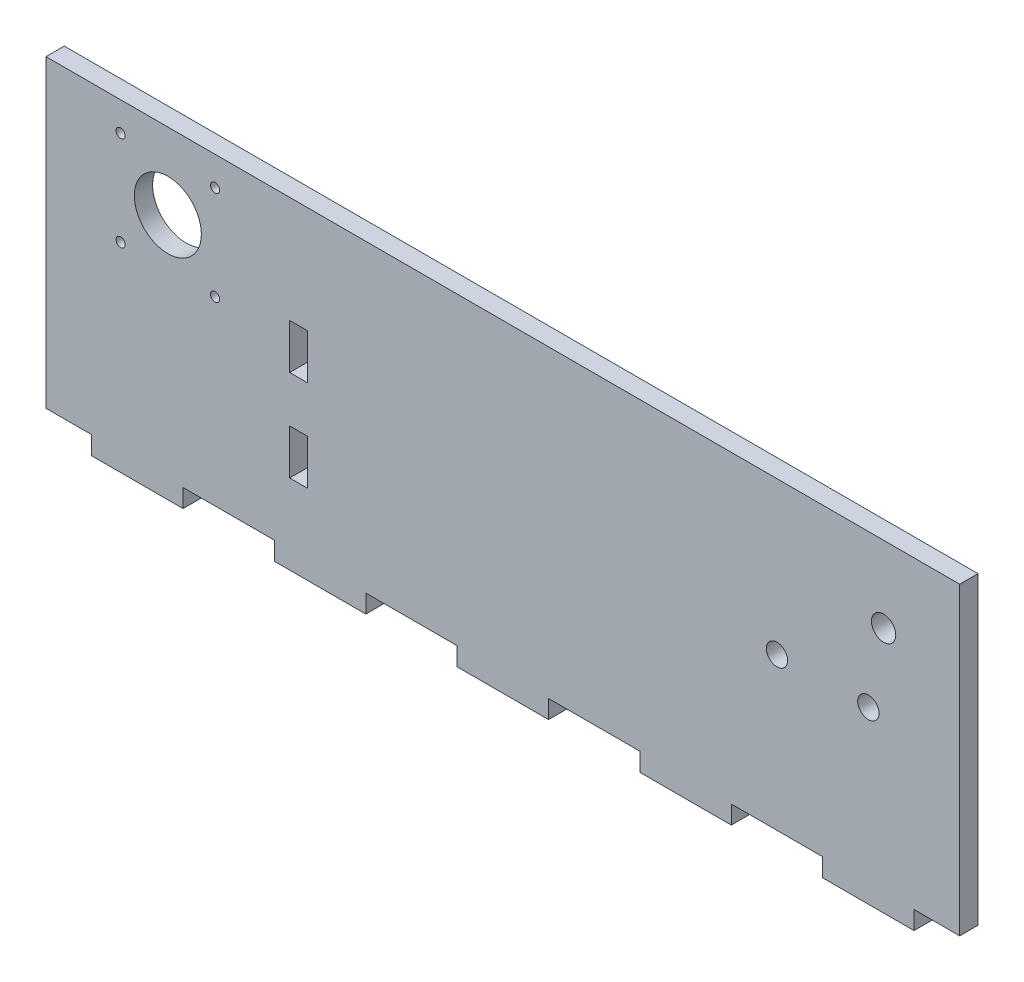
SolidWorks part; units mm, degrees
ref_plane "Alzado" through (0, 0, 0) normal (0, 0, 1) x (1, 0, 0)
ref_plane "Planta" through (0, 0, 0) normal (0, 1, 0) x (1, 0, 0)
ref_plane "Vista lateral" through (0, 0, 0) normal (1, 0, 0) x (0, 0, -1)
sketch "Sketch1" plane through (0, 0, 0) normal (0, 0, 1) x (1, 0, 0)
  line L0 (-75, -56) -> (-45, -56)
  line L1 (-150, -50) -> (-135, -50)
  line L2 (-150, -50) -> (-150, 50)
  line L3 (-150, 50) -> (150, 50)
  line L4 (150, -50) -> (150, 50)
  line L5 (-150, -50) -> (150, 50) construction
  line L6 (-150, 50) -> (150, -50) construction
  line L7 (-45, -50) -> (-15, -50)
  line L8 (-135, -50) -> (-135, -56)
  line L9 (-135, -56) -> (-105, -56)
  line L10 (-105, -50) -> (-105, -56)
  line L11 (-75, -50) -> (-75, -56)
  line L12 (-45, -50) -> (-45, -56)
  line L13 (-15, -56) -> (15, -56)
  line L14 (-15, -50) -> (-15, -56)
  line L15 (15, -50) -> (15, -56)
  line L16 (45, -56) -> (75, -56)
  line L17 (45, -50) -> (45, -56)
  line L18 (75, -50) -> (75, -56)
  line L19 (105, -56) -> (135, -56)
  line L20 (105, -50) -> (105, -56)
  line L21 (135, -50) -> (135, -56)
  line L22 (-105, -50) -> (-75, -50)
  line L23 (15, -50) -> (45, -50)
  line L24 (75, -50) -> (105, -50)
  line L25 (135, -50) -> (150, -50)
  point P0 (0, 0)
  point P10 (-120, -56)
  dimension "D1" = 300
  dimension "D2" = 100
  dimension "D3" = 30
  dimension "D4" = 6
  dimension "D5" = 30
  dimension "D6" = 5
extrude "Boss-Extrude1" add sketch "Sketch1" along normal blind 6
sketch "Sketch2" plane through (0, 0, 6) normal (0, 0, 1) x (1, 0, 0)
  line L0 (-150, 50) -> (-150, -50) construction
  line L1 (150, 50) -> (-150, 50) construction
  line L2 (150, -50) -> (150, 50) construction
  line L3 (-125.5, 9.5) -> (-94.5, 9.5) construction
  line L4 (-125.5, 9.5) -> (-125.5, 40.5) construction
  line L5 (-125.5, 40.5) -> (-94.5, 40.5) construction
  line L6 (-94.5, 9.5) -> (-94.5, 40.5) construction
  line L7 (-125.5, 9.5) -> (-94.5, 40.5) construction
  line L8 (-125.5, 40.5) -> (-94.5, 9.5) construction
  line L13 (-70, 15) -> (-64.2, 15)
  line L14 (-70, 15) -> (-70, 0.2)
  line L15 (-70, 0.2) -> (-64.2, 0.2)
  line L16 (-64.2, 15) -> (-64.2, 0.2)
  line L17 (-70, -15) -> (-64.2, -15)
  line L18 (-70, -15) -> (-70, -29.8)
  line L19 (-70, -29.8) -> (-64.2, -29.8)
  line L20 (-64.2, -15) -> (-64.2, -29.8)
  line L21 (135, -50) -> (150, -50) construction
  circle A0 centre (-110, 25) radius 11
  circle A1 centre (-125.5, 40.5) radius 1.5
  circle A2 centre (-94.5, 40.5) radius 1.5
  circle A3 centre (-94.5, 9.5) radius 1.5
  circle A4 centre (-125.5, 9.5) radius 1.5
  circle A9 centre (120, 0) radius 3.5
  circle A10 centre (90, 0) radius 3.5
  circle A12 centre (125, 25) radius 4
  point P31 (-70, 7.6)
  point P32 (-70, -22.4)
  dimension "D1" = 22
  dimension "D2" = 40
  dimension "D3" = 25
  dimension "D6" = 3
  dimension "D7" = 3
  dimension "D8" = 3
  dimension "D9" = 3
  dimension "D25" = 30
  dimension "D27" = 7
  dimension "D28" = 30
  dimension "D29" = 7
  dimension "D31" = 25
  dimension "D32" = 25
  dimension "D33" = 8
  dimension "D4" = 31
  dimension "D5" = 31
  dimension "D10" = 35
  dimension "D18" = 14.8
  dimension "D19" = 14.8
  dimension "D20" = 5.8
  dimension "D21" = 5.8
  dimension "D22" = 30
  dimension "D23" = 80
  dimension "D26" = 50
extrude "Cut-Extrude1" cut sketch "Sketch2" against normal up to next
